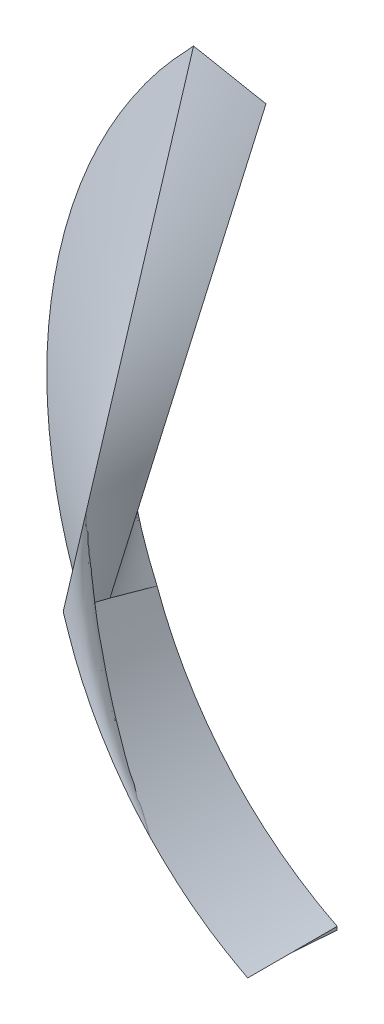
SolidWorks part; units mm, degrees
other "Objet de détail1"
ref_plane "Plan de face" through (0, 0, 0) normal (0, 0, 1) x (1, 0, 0)
ref_plane "Plan de dessus" through (0, 0, 0) normal (0, 1, 0) x (1, 0, 0)
ref_plane "Plan de droite" through (0, 0, 0) normal (1, 0, 0) x (0, 0, -1)
other "Cordon de soudure1"
